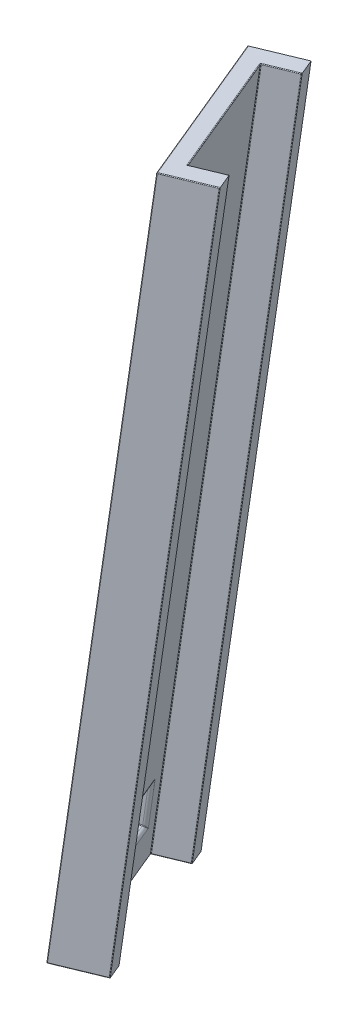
SolidWorks part; units mm, degrees
ref_plane "Front Plane" through (0, 0, 0) normal (0, 0, 1) x (1, 0, 0)
ref_plane "Top Plane" through (0, 0, 0) normal (0, 1, 0) x (1, 0, 0)
ref_plane "Right Plane" through (0, 0, 0) normal (1, 0, 0) x (0, 0, -1)
sketch "Sketch1" plane through (0, 0, 0) normal (0, 1, 0) x (1, 0, 0)
  line L0 (-20.0909, 48.5037) -> (-18.2923, 44.1614) construction
  line L1 (59.5316, 0) -> (42.0952, 42.0952) construction
  line L2 (42.0952, 42.0952) -> (0, 59.5316) construction
  line L3 (0, 59.5316) -> (-42.0952, 42.0952) construction
  line L4 (-42.0952, 42.0952) -> (-59.5316, 0) construction
  line L5 (-59.5316, 0) -> (-42.0952, -42.0952) construction
  line L6 (-42.0952, -42.0952) -> (0, -59.5316) construction
  line L7 (0, -59.5316) -> (42.0952, -42.0952) construction
  line L8 (42.0952, -42.0952) -> (59.5316, 0) construction
  line L9 (56.8256, 0) -> (40.1818, 40.1818) construction
  line L10 (40.1818, 40.1818) -> (0, 56.8256) construction
  line L11 (0, 56.8256) -> (-40.1818, 40.1818) construction
  line L12 (-40.1818, 40.1818) -> (-56.8256, 0) construction
  line L13 (-56.8256, 0) -> (-40.1818, -40.1818) construction
  line L14 (-40.1818, -40.1818) -> (0, -56.8256) construction
  line L15 (0, -56.8256) -> (40.1818, -40.1818) construction
  line L16 (40.1818, -40.1818) -> (56.8256, 0) construction
  line L17 (-29.3297, 44.6768) -> (-10.8521, 52.3305) construction
  line L18 (-27.5311, 40.3346) -> (-9.0535, 47.9883) construction
  line L19 (-29.3297, 44.6768) -> (-27.5311, 40.3346) construction
  line L20 (-10.8521, 52.3305) -> (-9.0535, 47.9883) construction
  line L21 (-31.6394, 43.7201) -> (-28.8841, 37.0682)
  line L22 (-28.8841, 37.0682) -> (-5.7871, 46.6353)
  line L23 (-8.5424, 53.2872) -> (-5.7871, 46.6353)
  line L24 (-31.6394, 43.7201) -> (-29.3297, 44.6768)
  line L25 (-29.3297, 44.6768) -> (-27.5311, 40.3346)
  line L26 (-27.5311, 40.3346) -> (-9.0535, 47.9883)
  line L27 (-9.0535, 47.9883) -> (-10.8521, 52.3305)
  line L28 (-10.8521, 52.3305) -> (-8.5424, 53.2872)
  line L29 (37.0682, 28.8841) -> (46.6353, 5.7871)
  line L30 (43.7201, 31.6394) -> (37.0682, 28.8841)
  line L31 (43.7201, 31.6394) -> (44.6768, 29.3297)
  line L32 (44.6768, 29.3297) -> (40.3346, 27.5311)
  line L33 (40.3346, 27.5311) -> (47.9883, 9.0535)
  line L34 (47.9883, 9.0535) -> (52.3305, 10.8521)
  line L35 (52.3305, 10.8521) -> (53.2872, 8.5424)
  line L36 (53.2872, 8.5424) -> (46.6353, 5.7871)
  line L37 (28.8841, -37.0682) -> (5.7871, -46.6353)
  line L38 (31.6394, -43.7201) -> (28.8841, -37.0682)
  line L39 (31.6394, -43.7201) -> (29.3297, -44.6768)
  line L40 (29.3297, -44.6768) -> (27.5311, -40.3346)
  line L41 (27.5311, -40.3346) -> (9.0535, -47.9883)
  line L42 (9.0535, -47.9883) -> (10.8521, -52.3305)
  line L43 (10.8521, -52.3305) -> (8.5424, -53.2872)
  line L44 (8.5424, -53.2872) -> (5.7871, -46.6353)
  line L45 (-37.0682, -28.8841) -> (-46.6353, -5.7871)
  line L46 (-43.7201, -31.6394) -> (-37.0682, -28.8841)
  line L47 (-43.7201, -31.6394) -> (-44.6768, -29.3297)
  line L48 (-44.6768, -29.3297) -> (-40.3346, -27.5311)
  line L49 (-40.3346, -27.5311) -> (-47.9883, -9.0535)
  line L50 (-47.9883, -9.0535) -> (-52.3305, -10.8521)
  line L51 (-52.3305, -10.8521) -> (-53.2872, -8.5424)
  line L52 (-53.2872, -8.5424) -> (-46.6353, -5.7871)
  circle A0 centre (0, 0) radius 7.4808 construction
  point P56 (0, 0)
  dimension "D6" = 4
  dimension "D1" = 110
  dimension "D2" = 2.5
  dimension "D3" = 20
  dimension "D4" = 2.5
  dimension "D5" = 4.7
ref_plane "Plane2" through (0, -105, 0) normal (0, 1, 0) x (1, 0, 0)
sketch "Sketch5" plane through (0, -105, 0) normal (0, 1, 0) x (1, 0, 0)
  line L0 (43.2957, 0) -> (30.6147, 30.6147) construction
  line L1 (46.0017, 0) -> (32.5281, 32.5281) construction
  line L2 (32.5281, 32.5281) -> (0, 46.0017) construction
  line L3 (0, 46.0017) -> (-32.5281, 32.5281) construction
  line L4 (-32.5281, 32.5281) -> (-46.0017, 0) construction
  line L5 (-46.0017, 0) -> (-32.5281, -32.5281) construction
  line L6 (-32.5281, -32.5281) -> (0, -46.0017) construction
  line L7 (0, -46.0017) -> (32.5281, -32.5281) construction
  line L8 (32.5281, -32.5281) -> (46.0017, 0) construction
  line L9 (30.6147, 30.6147) -> (0, 43.2957) construction
  line L10 (0, 43.2957) -> (-30.6147, 30.6147) construction
  line L11 (-30.6147, 30.6147) -> (-43.2957, 0) construction
  line L12 (-43.2957, 0) -> (-30.6147, -30.6147) construction
  line L13 (-30.6147, -30.6147) -> (0, -43.2957) construction
  line L14 (0, -43.2957) -> (30.6147, -30.6147) construction
  line L15 (30.6147, -30.6147) -> (43.2957, 0) construction
  line L16 (-15.3073, 36.9552) -> (-13.5087, 32.6129) construction
  line L17 (-22.7475, 28.7861) -> (-4.2699, 36.4398)
  line L18 (-22.7475, 28.7861) -> (-24.5461, 33.1283)
  line L19 (-4.2699, 36.4398) -> (-6.0685, 40.782)
  line L20 (-1.0035, 35.0868) -> (-3.7588, 41.7387)
  line L21 (-24.1005, 25.5197) -> (-1.0035, 35.0868)
  line L22 (-24.1005, 25.5197) -> (-26.8558, 32.1716)
  line L23 (-26.8558, 32.1716) -> (-24.5461, 33.1283)
  line L24 (-6.0685, 40.782) -> (-3.7588, 41.7387)
  line L25 (25.5197, 24.1005) -> (35.0868, 1.0035)
  line L26 (28.7861, 22.7475) -> (36.4398, 4.2699)
  line L27 (28.7861, 22.7475) -> (33.1283, 24.5461)
  line L28 (32.1716, 26.8558) -> (33.1283, 24.5461)
  line L29 (25.5197, 24.1005) -> (32.1716, 26.8558)
  line L30 (36.4398, 4.2699) -> (40.782, 6.0685)
  line L31 (35.0868, 1.0035) -> (41.7387, 3.7588)
  line L32 (40.782, 6.0685) -> (41.7387, 3.7588)
  line L33 (24.1005, -25.5197) -> (1.0035, -35.0868)
  line L34 (22.7475, -28.7861) -> (4.2699, -36.4398)
  line L35 (22.7475, -28.7861) -> (24.5461, -33.1283)
  line L36 (26.8558, -32.1716) -> (24.5461, -33.1283)
  line L37 (24.1005, -25.5197) -> (26.8558, -32.1716)
  line L38 (4.2699, -36.4398) -> (6.0685, -40.782)
  line L39 (1.0035, -35.0868) -> (3.7588, -41.7387)
  line L40 (6.0685, -40.782) -> (3.7588, -41.7387)
  line L41 (-25.5197, -24.1005) -> (-35.0868, -1.0035)
  line L42 (-28.7861, -22.7475) -> (-36.4398, -4.2699)
  line L43 (-28.7861, -22.7475) -> (-33.1283, -24.5461)
  line L44 (-32.1716, -26.8558) -> (-33.1283, -24.5461)
  line L45 (-25.5197, -24.1005) -> (-32.1716, -26.8558)
  line L46 (-36.4398, -4.2699) -> (-40.782, -6.0685)
  line L47 (-35.0868, -1.0035) -> (-41.7387, -3.7588)
  line L48 (-40.782, -6.0685) -> (-41.7387, -3.7588)
  point P54 (0, 0)
  dimension "D1" = 85
  dimension "D3" = 20
  dimension "D4" = 4.7
  dimension "D5" = 2.5
  dimension "D6" = 4
  dimension "D2" = 2.5
loft "Loft1" add
sketch "Sketch6" plane through (43.5443, -5.611, -18.0366) normal (0.9174, -0.1182, -0.38) x (-0.3769, 0.0486, -0.925)
  line L0 (-11.8971, -89.6162) -> (3.085, -90.3498)
  line L1 (5.0929, -100.4601) -> (-14.8832, -99.482) construction
  line L2 (-4.8951, -99.9711) -> (-4.4061, -89.983) construction
  line L3 (-11.8971, -89.6162) -> (-12.1269, -94.3106)
  line L4 (3.085, -90.3498) -> (2.8551, -95.0442)
  line L5 (-12.1269, -94.3106) -> (2.8551, -95.0442)
  point P2 (-4.4061, -89.983)
  point P3 (-4.8951, -99.9711)
  dimension "D1" = 15
  dimension "D2" = 10
extrude "Cut-Extrude1" cut sketch "Sketch6" against normal blind 10
fillet "Fillet1" radius 10 1 edges at (31.4277, -94.7767, -13.0178)
fillet "Fillet2" radius 0.5 7 edges at (30.5783, -97.4036, -20.7839) (33.7051, -95.0701, -13.9611) (36.3186, -97.4036, -6.9257) (33.1918, -99.7372, -13.7485) (30.9144, -99.4437, -12.8051) (34.4012, -93.8361, -6.1315) (28.661, -93.8361, -19.9897)
fillet "Fillet3" radius 0.1 27 edges at (35.9676, -99.8653, -6.6218) (34.9232, -99.5904, -6.3477) (33.9589, -99.6064, -5.7898) (28.1065, -99.6064, -19.9186) (30.7696, -93.9159, -21.0216) (30.1153, -99.8653, -20.7506) (36.6219, -93.9159, -6.8929) (29.1829, -99.5904, -20.2059) (29.6919, -92.5884, -20.4167) (35.4321, -92.5884, -6.5585) (36.0115, -93.9298, -6.7985) (30.2712, -93.9298, -20.6567) (35.0274, -90.398, -6.3089) (29.2291, -90.398, -20.3071)
